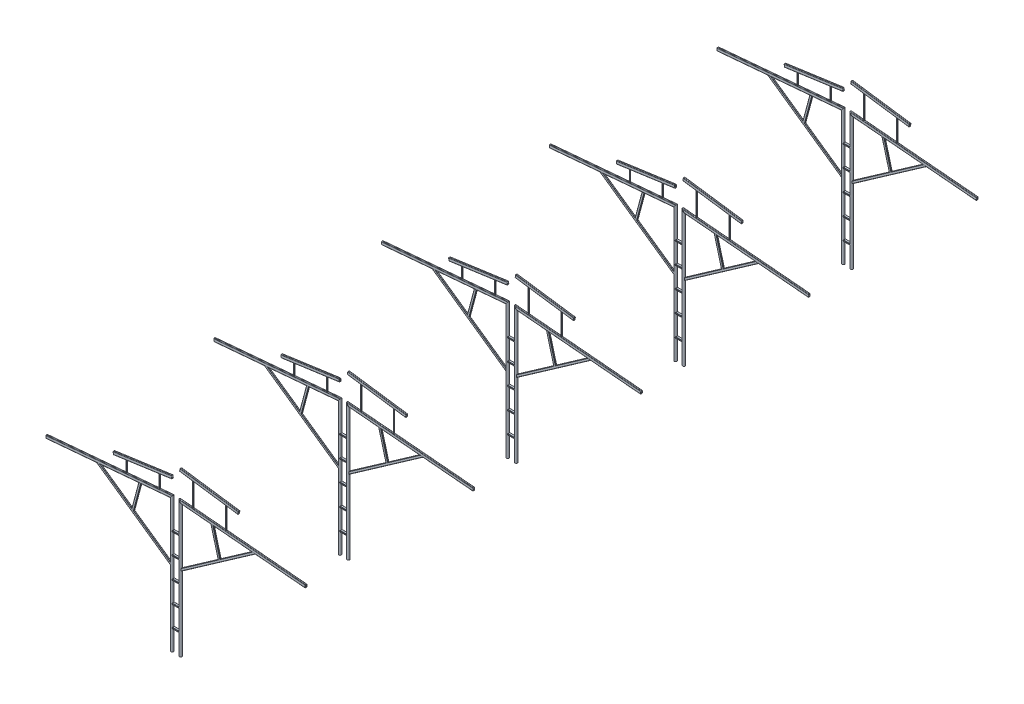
SolidWorks part; units mm, degrees
ref_plane "Front Plane" through (0, 0, 0) normal (0, 0, 1) x (1, 0, 0)
ref_plane "Top Plane" through (0, 0, 0) normal (0, 1, 0) x (1, 0, 0)
ref_plane "Right Plane" through (0, 0, 0) normal (1, 0, 0) x (0, 0, -1)
other "Configuration Table"
ref_plane "Plane1" through (0, 0, 4000) normal (0, 0, 1) x (1, 0, 0)
ref_plane "Plane2" through (0, 0, 8000) normal (0, 0, 1) x (1, 0, 0)
ref_plane "Plane3" through (0, 0, 12000) normal (0, 0, 1) x (1, 0, 0)
ref_plane "Plane4" through (0, 0, 16000) normal (0, 0, 1) x (1, 0, 0)
sketch "Sketch1" plane through (0, 0, 0) normal (0, 0, 1) x (1, 0, 0)
  line L0 (-200, 0) -> (-200, 3200)
  line L1 (0, 0) -> (0, 3200)
  line L2 (-200, 3200) -> (-3188.5841, 2938.5328)
  line L3 (0, 3200) -> (2988.5841, 2938.5328)
  line L4 (-200, 1782.1468) -> (-2000, 3042.5204)
  line L5 (-950, 3134.3835) -> (-1136.6049, 2437.9646)
  line L6 (0, 1782.1468) -> (1800, 3042.5204)
  line L7 (750, 3134.3835) -> (936.6049, 2437.9646)
  line L8 (-100, 436.796) -> (-100, 4123.4848) construction
  line L9 (-500, 3173.7534) -> (-500, 3557.8377)
  line L10 (-1286.3753, 3104.9545) -> (-1286.3753, 3447.3199)
  line L11 (-1586.3753, 3405.1577) -> (-200, 3600)
  line L12 (0, 3850) -> (1386.3753, 3655.1577)
  line L13 (300, 3807.8377) -> (300, 3173.7534)
  line L14 (1086.3753, 3697.3199) -> (1086.3753, 3104.9545)
  dimension "D1" = 3200
  dimension "D2" = 3200
  dimension "D3" = 200
  dimension "D4" = 85
  dimension "D5" = 3000
  dimension "D6" = 85
  dimension "D7" = 40
  dimension "D8" = 70
  dimension "D9" = 750
  dimension "D10" = 1800
  dimension "D11" = 1800
  dimension "D12" = 750
  dimension "D13" = 70
  dimension "D14" = 1400
  dimension "D15" = 400
  dimension "D16" = 300
  dimension "D17" = 300
  dimension "D18" = 3
  dimension "D19" = 650
  dimension "D20" = 1400
  dimension "D21" = 300
  dimension "D22" = 3
  dimension "D23" = 300
sketch "Sketch3" plane through (0, 0, 4000) normal (0, 0, 1) x (1, 0, 0)
  line L0 (-1286.3753, 3104.9545) -> (-1286.3753, 3447.3199) construction
  line L1 (750, 3134.3835) -> (936.6049, 2437.9646) construction
  line L2 (0, 1782.1468) -> (1800, 3042.5204) construction
  line L3 (-950, 3134.3835) -> (-1136.6049, 2437.9646) construction
  line L4 (-200, 1782.1468) -> (-2000, 3042.5204) construction
  line L5 (0, 0) -> (0, 3200) construction
  line L6 (0, 3200) -> (2988.5841, 2938.5328) construction
  line L7 (-200, 0) -> (-200, 3200) construction
  line L8 (-200, 3200) -> (-3188.5841, 2938.5328) construction
  line L9 (1086.3753, 3697.3199) -> (1086.3753, 3104.9545) construction
  line L10 (300, 3807.8377) -> (300, 3173.7534) construction
  line L11 (-1586.3753, 3405.1577) -> (-200, 3600) construction
  line L12 (-500, 3173.7534) -> (-500, 3557.8377) construction
  line L13 (0, 3850) -> (1386.3753, 3655.1577) construction
  line L14 (-1286.3753, 3104.9545) -> (-1286.3753, 3447.3199)
  line L15 (750, 3134.3835) -> (936.6049, 2437.9646)
  line L16 (0, 1782.1468) -> (1800, 3042.5204)
  line L17 (-950, 3134.3835) -> (-1136.6049, 2437.9646)
  line L18 (-200, 1782.1468) -> (-2000, 3042.5204)
  line L19 (0, 0) -> (0, 3200)
  line L20 (0, 3200) -> (2988.5841, 2938.5328)
  line L21 (-200, 0) -> (-200, 3200)
  line L22 (-200, 3200) -> (-3188.5841, 2938.5328)
  line L23 (1086.3753, 3697.3199) -> (1086.3753, 3104.9545)
  line L24 (300, 3807.8377) -> (300, 3173.7534)
  line L25 (-1586.3753, 3405.1577) -> (-200, 3600)
  line L26 (-500, 3173.7534) -> (-500, 3557.8377)
  line L27 (0, 3850) -> (1386.3753, 3655.1577)
sketch "Sketch4" plane through (0, 0, 8000) normal (0, 0, 1) x (1, 0, 0)
  line L0 (-1286.3753, 3104.9545) -> (-1286.3753, 3447.3199) construction
  line L1 (750, 3134.3835) -> (936.6049, 2437.9646) construction
  line L2 (0, 1782.1468) -> (1800, 3042.5204) construction
  line L3 (-950, 3134.3835) -> (-1136.6049, 2437.9646) construction
  line L4 (-200, 1782.1468) -> (-2000, 3042.5204) construction
  line L5 (0, 0) -> (0, 3200) construction
  line L6 (0, 3200) -> (2988.5841, 2938.5328) construction
  line L7 (-200, 0) -> (-200, 3200) construction
  line L8 (-200, 3200) -> (-3188.5841, 2938.5328) construction
  line L9 (1086.3753, 3697.3199) -> (1086.3753, 3104.9545) construction
  line L10 (300, 3807.8377) -> (300, 3173.7534) construction
  line L11 (-1586.3753, 3405.1577) -> (-200, 3600) construction
  line L12 (-500, 3173.7534) -> (-500, 3557.8377) construction
  line L13 (0, 3850) -> (1386.3753, 3655.1577) construction
  line L14 (-1286.3753, 3104.9545) -> (-1286.3753, 3447.3199)
  line L15 (750, 3134.3835) -> (936.6049, 2437.9646)
  line L16 (0, 1782.1468) -> (1800, 3042.5204)
  line L17 (-950, 3134.3835) -> (-1136.6049, 2437.9646)
  line L18 (-200, 1782.1468) -> (-2000, 3042.5204)
  line L19 (0, 0) -> (0, 3200)
  line L20 (0, 3200) -> (2988.5841, 2938.5328)
  line L21 (-200, 0) -> (-200, 3200)
  line L22 (-200, 3200) -> (-3188.5841, 2938.5328)
  line L23 (1086.3753, 3697.3199) -> (1086.3753, 3104.9545)
  line L24 (300, 3807.8377) -> (300, 3173.7534)
  line L25 (-1586.3753, 3405.1577) -> (-200, 3600)
  line L26 (-500, 3173.7534) -> (-500, 3557.8377)
  line L27 (0, 3850) -> (1386.3753, 3655.1577)
sketch "Sketch5" plane through (0, 0, 12000) normal (0, 0, 1) x (1, 0, 0)
  line L0 (-1286.3753, 3104.9545) -> (-1286.3753, 3447.3199) construction
  line L1 (750, 3134.3835) -> (936.6049, 2437.9646) construction
  line L2 (0, 1782.1468) -> (1800, 3042.5204) construction
  line L3 (-950, 3134.3835) -> (-1136.6049, 2437.9646) construction
  line L4 (-200, 1782.1468) -> (-2000, 3042.5204) construction
  line L5 (0, 0) -> (0, 3200) construction
  line L6 (0, 3200) -> (2988.5841, 2938.5328) construction
  line L7 (-200, 0) -> (-200, 3200) construction
  line L8 (-200, 3200) -> (-3188.5841, 2938.5328) construction
  line L9 (1086.3753, 3697.3199) -> (1086.3753, 3104.9545) construction
  line L10 (300, 3807.8377) -> (300, 3173.7534) construction
  line L11 (-1586.3753, 3405.1577) -> (-200, 3600) construction
  line L12 (-500, 3173.7534) -> (-500, 3557.8377) construction
  line L13 (0, 3850) -> (1386.3753, 3655.1577) construction
  line L14 (-1286.3753, 3104.9545) -> (-1286.3753, 3447.3199)
  line L15 (750, 3134.3835) -> (936.6049, 2437.9646)
  line L16 (0, 1782.1468) -> (1800, 3042.5204)
  line L17 (-950, 3134.3835) -> (-1136.6049, 2437.9646)
  line L18 (-200, 1782.1468) -> (-2000, 3042.5204)
  line L19 (0, 0) -> (0, 3200)
  line L20 (0, 3200) -> (2988.5841, 2938.5328)
  line L21 (-200, 0) -> (-200, 3200)
  line L22 (-200, 3200) -> (-3188.5841, 2938.5328)
  line L23 (1086.3753, 3697.3199) -> (1086.3753, 3104.9545)
  line L24 (300, 3807.8377) -> (300, 3173.7534)
  line L25 (-1586.3753, 3405.1577) -> (-200, 3600)
  line L26 (-500, 3173.7534) -> (-500, 3557.8377)
  line L27 (0, 3850) -> (1386.3753, 3655.1577)
sketch "Sketch6" plane through (0, 0, 16000) normal (0, 0, 1) x (1, 0, 0)
  line L0 (-1286.3753, 3104.9545) -> (-1286.3753, 3447.3199) construction
  line L1 (750, 3134.3835) -> (936.6049, 2437.9646) construction
  line L2 (0, 1782.1468) -> (1800, 3042.5204) construction
  line L3 (-950, 3134.3835) -> (-1136.6049, 2437.9646) construction
  line L4 (-200, 1782.1468) -> (-2000, 3042.5204) construction
  line L5 (0, 0) -> (0, 3200) construction
  line L6 (0, 3200) -> (2988.5841, 2938.5328) construction
  line L7 (-200, 0) -> (-200, 3200) construction
  line L8 (-200, 3200) -> (-3188.5841, 2938.5328) construction
  line L9 (1086.3753, 3697.3199) -> (1086.3753, 3104.9545) construction
  line L10 (300, 3807.8377) -> (300, 3173.7534) construction
  line L11 (-1586.3753, 3405.1577) -> (-200, 3600) construction
  line L12 (-500, 3173.7534) -> (-500, 3557.8377) construction
  line L13 (0, 3850) -> (1386.3753, 3655.1577) construction
  line L14 (-1286.3753, 3104.9545) -> (-1286.3753, 3447.3199)
  line L15 (750, 3134.3835) -> (936.6049, 2437.9646)
  line L16 (0, 1782.1468) -> (1800, 3042.5204)
  line L17 (-950, 3134.3835) -> (-1136.6049, 2437.9646)
  line L18 (-200, 1782.1468) -> (-2000, 3042.5204)
  line L19 (0, 0) -> (0, 3200)
  line L20 (0, 3200) -> (2988.5841, 2938.5328)
  line L21 (-200, 0) -> (-200, 3200)
  line L22 (-200, 3200) -> (-3188.5841, 2938.5328)
  line L23 (1086.3753, 3697.3199) -> (1086.3753, 3104.9545)
  line L24 (300, 3807.8377) -> (300, 3173.7534)
  line L25 (-1586.3753, 3405.1577) -> (-200, 3600)
  line L26 (-500, 3173.7534) -> (-500, 3557.8377)
  line L27 (0, 3850) -> (1386.3753, 3655.1577)
ref_plane "Plane12" through (-200, 0, 16000) normal (0, -1, 0) x (1, 0, 0)
sketch "Sketch19" plane through (-200, 0, 16000) normal (0, -1, 0) x (1, 0, 0)
  circle A0 centre (0, 0) radius 26.15
  circle A1 centre (0, 0) radius 30.15
  point P3 (0, 0)
  dimension "In_dia" = 52.3
  dimension "Out_dia" = 60.3
other "Structure System1"
sketch3d "Structure System Grid1"
  line L0 (-200, 0, 16000) -> (-200, 3200, 16000)
  line L1 (-200, 0, 12000) -> (-200, 3200, 12000)
  line L2 (-200, 0, 8000) -> (-200, 3200, 8000)
  line L3 (-200, 0, 4000) -> (-200, 3200, 4000)
  line L4 (-200, 0, 0) -> (-200, 3200, 0)
  line L5 (0, 0, 16000) -> (0, 3200, 16000)
  line L6 (0, 0, 12000) -> (0, 3200, 12000)
  line L7 (0, 0, 8000) -> (0, 3200, 8000)
  line L8 (0, 0, 4000) -> (0, 3200, 4000)
  line L9 (0, 0, 0) -> (0, 3200, 0)
  line L10 (-200, 3200, 16000) -> (-3188.5841, 2938.5328, 16000)
  line L11 (-200, 3200, 12000) -> (-3188.5841, 2938.5328, 12000)
  line L12 (-200, 3200, 8000) -> (-3188.5841, 2938.5328, 8000)
  line L13 (-200, 3200, 4000) -> (-3188.5841, 2938.5328, 4000)
  line L14 (-200, 3200, 0) -> (-3188.5841, 2938.5328, 0)
  line L15 (0, 3200, 16000) -> (2988.5841, 2938.5328, 16000)
  line L16 (0, 3200, 12000) -> (2988.5841, 2938.5328, 12000)
  line L17 (0, 3200, 8000) -> (2988.5841, 2938.5328, 8000)
  line L18 (0, 3200, 4000) -> (2988.5841, 2938.5328, 4000)
  line L19 (0, 3200, 0) -> (2988.5841, 2938.5328, 0)
  line L20 (-1586.3753, 3405.1577, 16000) -> (-200, 3600, 16000)
  line L21 (-1586.3753, 3405.1577, 12000) -> (-200, 3600, 12000)
  line L22 (-1586.3753, 3405.1577, 8000) -> (-200, 3600, 8000)
  line L23 (-1586.3753, 3405.1577, 4000) -> (-200, 3600, 4000)
  line L24 (-1586.3753, 3405.1577, 0) -> (-200, 3600, 0)
  line L25 (0, 3850, 0) -> (1386.3753, 3655.1577, 0)
  line L26 (0, 3850, 4000) -> (1386.3753, 3655.1577, 4000)
  line L27 (0, 3850, 8000) -> (1386.3753, 3655.1577, 8000)
  line L28 (0, 3850, 12000) -> (1386.3753, 3655.1577, 12000)
  line L29 (0, 3850, 16000) -> (1386.3753, 3655.1577, 16000)
  line L30 (-1286.3753, 3104.9545, 16000) -> (-1286.3753, 3447.3199, 16000)
  line L31 (-1286.3753, 3104.9545, 12000) -> (-1286.3753, 3447.3199, 12000)
  line L32 (-1286.3753, 3104.9545, 8000) -> (-1286.3753, 3447.3199, 8000)
  line L33 (-1286.3753, 3104.9545, 4000) -> (-1286.3753, 3447.3199, 4000)
  line L34 (-1286.3753, 3104.9545, 0) -> (-1286.3753, 3447.3199, 0)
  line L35 (-500, 3173.7534, 16000) -> (-500, 3557.8377, 16000)
  line L36 (-500, 3173.7534, 12000) -> (-500, 3557.8377, 12000)
  line L37 (-500, 3173.7534, 8000) -> (-500, 3557.8377, 8000)
  line L38 (-500, 3173.7534, 4000) -> (-500, 3557.8377, 4000)
  line L39 (-500, 3173.7534, 0) -> (-500, 3557.8377, 0)
  line L40 (300, 3807.8377, 16000) -> (300, 3173.7534, 16000)
  line L41 (300, 3807.8377, 12000) -> (300, 3173.7534, 12000)
  line L42 (300, 3807.8377, 8000) -> (300, 3173.7534, 8000)
  line L43 (300, 3807.8377, 4000) -> (300, 3173.7534, 4000)
  line L44 (300, 3807.8377, 0) -> (300, 3173.7534, 0)
  line L45 (1086.3753, 3697.3199, 16000) -> (1086.3753, 3104.9545, 16000)
  line L46 (1086.3753, 3697.3199, 12000) -> (1086.3753, 3104.9545, 12000)
  line L47 (1086.3753, 3697.3199, 8000) -> (1086.3753, 3104.9545, 8000)
  line L48 (1086.3753, 3697.3199, 4000) -> (1086.3753, 3104.9545, 4000)
  line L49 (1086.3753, 3697.3199, 0) -> (1086.3753, 3104.9545, 0)
  line L50 (-950, 3134.3835, 16000) -> (-1136.6049, 2437.9646, 16000)
  line L51 (-950, 3134.3835, 12000) -> (-1136.6049, 2437.9646, 12000)
  line L52 (-950, 3134.3835, 8000) -> (-1136.6049, 2437.9646, 8000)
  line L53 (-950, 3134.3835, 4000) -> (-1136.6049, 2437.9646, 4000)
  line L54 (-950, 3134.3835, 0) -> (-1136.6049, 2437.9646, 0)
  line L55 (750, 3134.3835, 16000) -> (936.6049, 2437.9646, 16000)
  line L56 (750, 3134.3835, 12000) -> (936.6049, 2437.9646, 12000)
  line L57 (750, 3134.3835, 8000) -> (936.6049, 2437.9646, 8000)
  line L58 (750, 3134.3835, 4000) -> (936.6049, 2437.9646, 4000)
  line L59 (750, 3134.3835, 0) -> (936.6049, 2437.9646, 0)
  line L60 (-200, 1782.1468, 16000) -> (-2000, 3042.5204, 16000)
  line L61 (-200, 1782.1468, 12000) -> (-2000, 3042.5204, 12000)
  line L62 (-200, 1782.1468, 8000) -> (-2000, 3042.5204, 8000)
  line L63 (-200, 1782.1468, 4000) -> (-2000, 3042.5204, 4000)
  line L64 (-200, 1782.1468, 0) -> (-2000, 3042.5204, 0)
  line L65 (0, 1782.1468, 16000) -> (1800, 3042.5204, 16000)
  line L66 (0, 1782.1468, 12000) -> (1800, 3042.5204, 12000)
  line L67 (0, 1782.1468, 8000) -> (1800, 3042.5204, 8000)
  line L68 (0, 1782.1468, 4000) -> (1800, 3042.5204, 4000)
  line L69 (0, 1782.1468, 0) -> (1800, 3042.5204, 0)
  line L110 (-200, 2500, 16000) -> (0, 2500, 16000)
  line L111 (-200, 2000, 16000) -> (0, 2000, 16000)
  line L112 (-200, 1500, 16000) -> (0, 1500, 16000)
  line L113 (-200, 1000, 16000) -> (0, 1000, 16000)
  line L114 (-200, 500, 16000) -> (0, 500, 16000)
  line L115 (-200, 2500, 12000) -> (0, 2500, 12000)
  line L116 (-200, 2000, 12000) -> (0, 2000, 12000)
  line L117 (-200, 1500, 12000) -> (0, 1500, 12000)
  line L118 (-200, 1000, 12000) -> (0, 1000, 12000)
  line L119 (-200, 500, 12000) -> (0, 500, 12000)
  line L120 (-200, 2500, 8000) -> (0, 2500, 8000)
  line L121 (-200, 2000, 8000) -> (0, 2000, 8000)
  line L122 (-200, 1500, 8000) -> (0, 1500, 8000)
  line L123 (-200, 1000, 8000) -> (0, 1000, 8000)
  line L124 (-200, 500, 8000) -> (0, 500, 8000)
  line L125 (-200, 2500, 4000) -> (0, 2500, 4000)
  line L126 (-200, 2000, 4000) -> (0, 2000, 4000)
  line L127 (-200, 1500, 4000) -> (0, 1500, 4000)
  line L128 (-200, 1000, 4000) -> (0, 1000, 4000)
  line L129 (-200, 500, 4000) -> (0, 500, 4000)
  line L130 (-200, 2500, 0) -> (0, 2500, 0)
  line L131 (-200, 2000, 0) -> (0, 2000, 0)
  line L132 (-200, 1500, 0) -> (0, 1500, 0)
  line L133 (-200, 1000, 0) -> (0, 1000, 0)
  line L134 (-200, 500, 0) -> (0, 500, 0)
other "<Circular Tube><60.3 x 5.0><>(2)"
ref_plane "Plane16" through (-200, 0, 16000) normal (0, -1, 0) x (1, 0, 0)
sketch "Sketch114" plane through (-200, 0, 16000) normal (0, -1, 0) x (1, 0, 0)
  circle A0 centre (0, 0) radius 25.15
  circle A1 centre (0, 0) radius 30.15
  point P3 (0, 0)
  dimension "In_dia" = 50.3
  dimension "Out_dia" = 60.3
other "Member151"
other "Member152"
other "Member153"
other "Member154"
other "Member155"
other "Member156"
other "Member157"
other "Member158"
other "Member159"
other "Member160"
other "<Tube (1)"
ref_plane "Plane17" through (-200, 3200, 16000) normal (0.9962, 0.0872, 0) x (0, 0, 1)
sketch "Sketch115" plane through (-200, 3200, 16000) normal (0.9962, 0.0872, 0) x (0, 0, 1)
  line L0 (-10, -30) -> (10, -30)
  line L1 (-15, -25) -> (-15, 25)
  line L2 (10, 30) -> (-10, 30)
  line L3 (15, 25) -> (15, -25)
  line L4 (-10, -35) -> (10, -35)
  line L5 (-20, -25) -> (-20, 25)
  line L6 (10, 35) -> (-10, 35)
  line L7 (20, 25) -> (20, -25)
  line L8 (-20, 0) -> (-15, 0) construction
  line L9 (-15, 0) -> (15, 0) construction
  line L10 (15, 0) -> (20, 0) construction
  line L11 (0, 35) -> (0, 30) construction
  line L12 (0, 30) -> (0, -30) construction
  line L13 (0, -30) -> (0, -35) construction
  arc A0 (20, 25) -> (10, 35) centre (10, 25) ccw
  arc A1 (10, -35) -> (20, -25) centre (10, -25) ccw
  arc A2 (-20, -25) -> (-10, -35) centre (-10, -25) ccw
  arc A3 (-10, 35) -> (-20, 25) centre (-10, 25) ccw
  arc A4 (-10, 30) -> (-15, 25) centre (-10, 25) ccw
  arc A5 (15, 25) -> (10, 30) centre (10, 25) ccw
  arc A6 (10, -30) -> (15, -25) centre (10, -25) ccw
  arc A7 (-15, -25) -> (-10, -30) centre (-10, -25) ccw
  point P6 (-20, 35)
  point P33 (-20, -35)
  point P34 (20, -35)
  point P36 (20, 35)
  point P37 (0, 0)
  dimension "D1" = 10
  dimension "Thickness" = 5
  dimension "V_leg" = 70
  dimension "H_leg" = 40
other "Member161"
other "Member162"
other "Member163"
other "Member164"
other "Member165"
other "Member166"
other "Member167"
other "Member168"
other "Member169"
other "Member170"
other "Member171"
other "Member172"
other "Member173"
other "Member174"
other "Member175"
other "Member176"
other "Member177"
other "Member178"
other "Member179"
other "Member180"
other "<Tube (3)"
ref_plane "Plane19" through (-950, 3134.3835, 16000) normal (-0.2588, -0.9659, 0) x (0, 0, 1)
sketch "Sketch117" plane through (-950, 3134.3835, 16000) normal (-0.2588, -0.9659, 0) x (0, 0, 1)
  line L0 (-9.8, -22.4) -> (9.8, -22.4)
  line L1 (-12.4, -19.8) -> (-12.4, 19.8)
  line L2 (9.8, 22.4) -> (-9.8, 22.4)
  line L3 (12.4, 19.8) -> (12.4, -19.8)
  line L4 (-9.8, -25) -> (9.8, -25)
  line L5 (-15, -19.8) -> (-15, 19.8)
  line L6 (9.8, 25) -> (-9.8, 25)
  line L7 (15, 19.8) -> (15, -19.8)
  line L8 (-15, 0) -> (-12.4, 0) construction
  line L9 (-12.4, 0) -> (12.4, 0) construction
  line L10 (12.4, 0) -> (15, 0) construction
  line L11 (0, 25) -> (0, 22.4) construction
  line L12 (0, 22.4) -> (0, -22.4) construction
  line L13 (0, -22.4) -> (0, -25) construction
  arc A0 (15, 19.8) -> (9.8, 25) centre (9.8, 19.8) ccw
  arc A1 (9.8, -25) -> (15, -19.8) centre (9.8, -19.8) ccw
  arc A2 (-15, -19.8) -> (-9.8, -25) centre (-9.8, -19.8) ccw
  arc A3 (-9.8, 25) -> (-15, 19.8) centre (-9.8, 19.8) ccw
  arc A4 (-9.8, 22.4) -> (-12.4, 19.8) centre (-9.8, 19.8) ccw
  arc A5 (12.4, 19.8) -> (9.8, 22.4) centre (9.8, 19.8) ccw
  arc A6 (9.8, -22.4) -> (12.4, -19.8) centre (9.8, -19.8) ccw
  arc A7 (-12.4, -19.8) -> (-9.8, -22.4) centre (-9.8, -19.8) ccw
  point P6 (-15, 25)
  point P33 (-15, -25)
  point P34 (15, -25)
  point P36 (15, 25)
  point P37 (0, 0)
  dimension "D1" = 5.2
  dimension "Thickness" = 2.6
  dimension "V_leg" = 50
  dimension "H_leg" = 30
other "Member201"
other "Member202"
other "Member203"
other "Member204"
other "Member205"
other "Member206"
other "Member207"
other "Member208"
other "Member209"
other "Member210"
other "Member211"
other "Member212"
other "Member213"
other "Member214"
other "Member215"
other "Member216"
other "Member217"
other "Member218"
other "Member219"
other "Member220"
other "Member261"
other "Member262"
other "Member263"
other "Member264"
other "Member265"
other "Member266"
other "Member267"
other "Member268"
other "Member269"
other "Member270"
other "Member271"
other "Member272"
other "Member273"
other "Member274"
other "Member275"
other "Member276"
other "Member277"
other "Member278"
other "Member279"
other "Member280"
other "Member281"
other "Member282"
other "Member283"
other "Member284"
other "Member285"
other "<Tube (4)"
ref_plane "Plane20" through (-1286.3753, 3104.9545, 16000) normal (0, -1, 0) x (1, 0, 0)
sketch "Sketch118" plane through (-1286.3753, 3104.9545, 16000) normal (0, -1, 0) x (1, 0, 0)
  line L0 (-6, -8) -> (6, -8)
  line L1 (-8, -6) -> (-8, 6)
  line L2 (6, 8) -> (-6, 8)
  line L3 (8, 6) -> (8, -6)
  line L4 (-6, -10) -> (6, -10)
  line L5 (-10, -6) -> (-10, 6)
  line L6 (6, 10) -> (-6, 10)
  line L7 (10, 6) -> (10, -6)
  line L8 (-10, 0) -> (-8, 0) construction
  line L9 (-8, 0) -> (8, 0) construction
  line L10 (8, 0) -> (10, 0) construction
  line L12 (0, 10) -> (0, 8) construction
  line L13 (0, 8) -> (0, -8) construction
  line L14 (0, -8) -> (0, -10) construction
  arc A0 (10, 6) -> (6, 10) centre (6, 6) ccw
  arc A1 (6, -10) -> (10, -6) centre (6, -6) ccw
  arc A2 (-10, -6) -> (-6, -10) centre (-6, -6) ccw
  arc A3 (-6, 10) -> (-10, 6) centre (-6, 6) ccw
  arc A4 (-6, 8) -> (-8, 6) centre (-6, 6) ccw
  arc A5 (8, 6) -> (6, 8) centre (6, 6) ccw
  arc A6 (6, -8) -> (8, -6) centre (6, -6) ccw
  arc A7 (-8, -6) -> (-6, -8) centre (-6, -6) ccw
  point P2 (-10, 10)
  point P33 (-10, -10)
  point P34 (10, -10)
  point P36 (10, 10)
  point P37 (0, 0)
  dimension "D1" = 4
  dimension "Thickness" = 2
  dimension "V_leg" = 20
  dimension "H_leg" = 20
other "Member181"
other "Member182"
other "Member183"
other "Member184"
other "Member185"
other "Member186"
other "Member187"
other "Member188"
other "Member189"
other "Member190"
other "Member191"
other "Member192"
other "Member193"
other "Member194"
other "Member195"
other "Member196"
other "Member197"
other "Member198"
other "Member199"
other "Member200"
other "Corner Management1"
other "Simple Corner Group1"
other "Corner191"
other "Corner192"
other "Corner193"
other "Corner194"
other "Corner195"
other "Corner197"
other "Corner198"
other "Corner199"
other "Corner201"
other "Corner203"
other "Corner204"
other "Corner205"
other "Corner206"
other "Corner207"
other "Corner208"
other "Corner209"
other "Corner210"
other "Corner211"
other "Corner212"
other "Corner213"
other "Corner214"
other "Corner215"
other "Corner216"
other "Corner217"
other "Corner218"
other "Corner221"
other "Corner222"
other "Corner223"
other "Corner225"
other "Corner226"
other "Corner227"
other "Corner228"
other "Corner229"
other "Corner231"
other "Corner232"
other "Corner233"
other "Corner234"
other "Corner235"
other "Corner237"
other "Corner238"
other "Corner239"
other "Corner240"
other "Corner241"
other "Corner242"
other "Corner243"
other "Corner245"
other "Corner246"
other "Corner247"
other "Corner248"
other "Corner249"
other "Corner251"
other "Corner252"
other "Corner253"
other "Corner254"
other "Corner255"
other "Corner256"
other "Corner257"
other "Corner258"
other "Corner259"
other "Corner260"
other "Corner261"
other "Corner262"
other "Corner263"
other "Corner264"
other "Corner265"
other "Corner266"
other "Corner267"
other "Corner268"
other "Corner269"
other "Corner270"
other "Corner271"
other "Corner272"
other "Corner273"
other "Corner274"
other "Corner275"
other "Corner276"
other "Corner277"
other "Corner278"
other "Corner279"
other "Corner280"
other "Corner321"
other "Corner322"
other "Corner323"
other "Corner324"
other "Corner325"
other "Corner326"
other "Corner327"
other "Corner328"
other "Corner329"
other "Corner330"
other "Corner331"
other "Corner332"
other "Corner333"
other "Corner334"
other "Corner335"
other "Corner336"
other "Corner337"
other "Corner338"
other "Corner339"
other "Corner340"
other "Corner341"
other "Corner342"
other "Corner343"
other "Corner344"
other "Corner345"
other "Corner346"
other "Corner347"
other "Corner348"
other "Corner349"
other "Corner350"
other "Corner351"
other "Corner352"
other "Corner353"
other "Corner354"
other "Corner355"
other "Corner356"
other "Corner357"
other "Corner358"
other "Corner359"
other "Corner360"
other "Corner361"
other "Corner362"
other "Corner363"
other "Corner364"
other "Corner365"
other "Corner366"
other "Corner367"
other "Corner368"
other "Corner369"
other "Corner370"
other "Two member Corner Group1"
other "Corner230"
other "Corner244"
other "Corner200"
other "Corner220"
other "Corner236"
other "Corner219"
other "Corner196"
other "Corner202"
other "Corner224"
other "Corner250"
